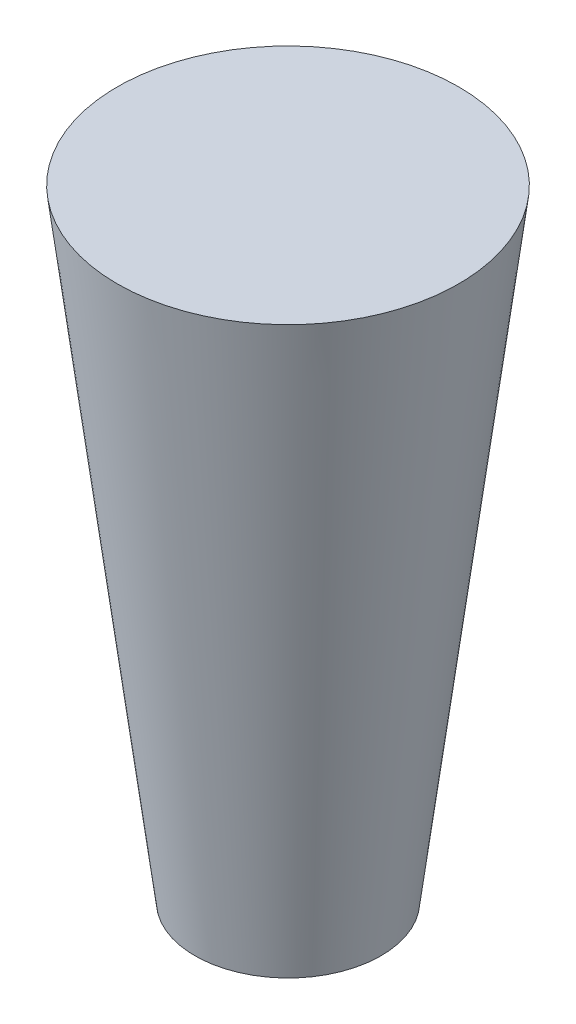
SolidWorks part; units mm, degrees
ref_plane "Front Plane" through (0, 0, 0) normal (0, 0, 1) x (1, 0, 0)
ref_plane "Top Plane" through (0, 0, 0) normal (0, 1, 0) x (1, 0, 0)
ref_plane "Right Plane" through (0, 0, 0) normal (1, 0, 0) x (0, 0, -1)
sketch "Sketch1" plane through (0, 0, 0) normal (0, 0, 1) x (1, 0, 0)
  line L0 (0, 0) -> (0, 33.3114) construction
  line L1 (0, 0) -> (-2.3813, 0)
  line L2 (-2.3813, 0) -> (-4.3656, 15.875)
  line L3 (-4.3656, 15.875) -> (0, 15.875)
  line L4 (0, 15.875) -> (0, 0)
  dimension "D1" = 8.7312
  dimension "D2" = 4.7625
  dimension "D3" = 15.875
revolve "Revolve1" add sketch "Sketch1" angle 360 about L0
